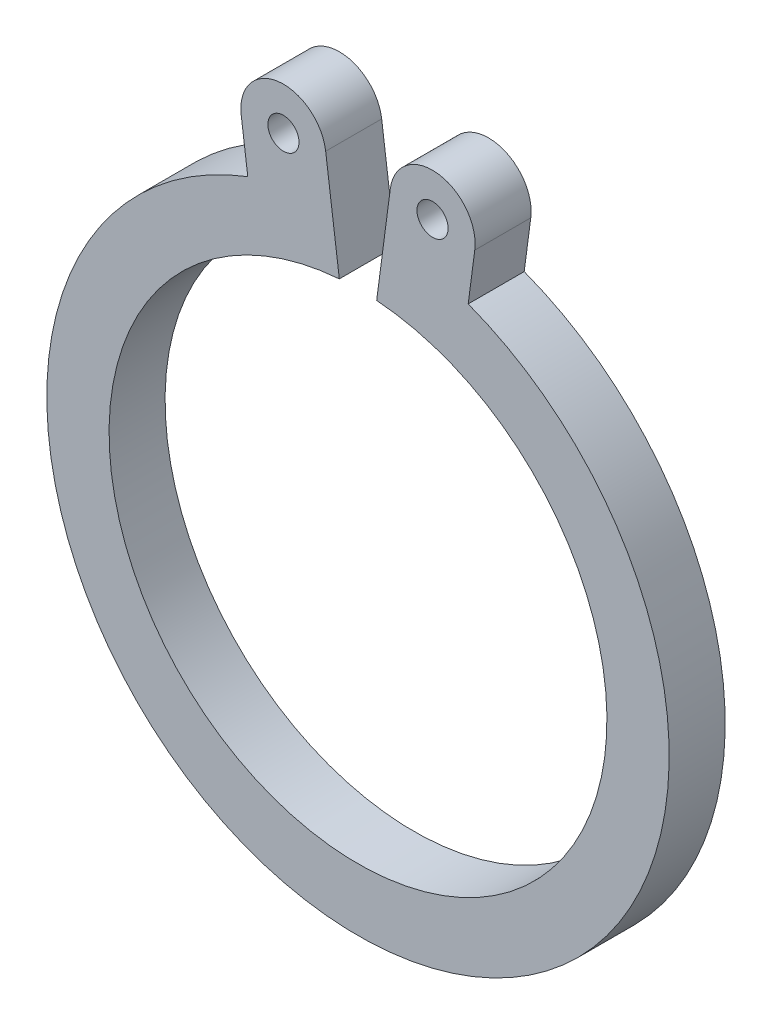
SolidWorks part; units mm, degrees
ref_plane "Plane1" through (0, 0, 0) normal (0, 0, 1) x (1, 0, 0)
ref_plane "Plane2" through (0, 0, 0) normal (0, 1, 0) x (1, 0, 0)
ref_plane "Plane3" through (0, 0, 0) normal (1, 0, 0) x (0, 0, -1)
sketch "Sketch1" plane through (0, 0, 0) normal (0, 0, 1) x (1, 0, 0)
  line L0 (0.5194, 5.6555) -> (0.3, 3.9887)
  line L1 (-1.7707, 4.676) -> (-1.8762, 5.4768)
  line L2 (1.7707, 4.676) -> (1.8762, 5.4768)
  line L3 (0, 0) -> (0, 66.3581) construction
  line L4 (-0.5194, 5.6555) -> (-0.3, 3.9887)
  line L5 (-0.5194, 5.6555) -> (-1.8762, 5.4768) construction
  line L6 (0.5194, 5.6555) -> (1.8762, 5.4768) construction
  arc A0 (-0.3, 3.9887) -> (0.3, 3.9887) centre (0, 0) ccw
  arc A1 (-1.7707, 4.676) -> (1.7707, 4.676) centre (0, 0) ccw
  arc A2 (-0.5194, 5.6555) -> (-1.8762, 5.4768) centre (-1.1978, 5.5661) ccw
  arc A3 (1.8762, 5.4768) -> (0.5194, 5.6555) centre (1.1978, 5.5661) ccw
  circle A4 centre (1.1978, 5.5661) radius 0.25
  circle A5 centre (-1.1978, 5.5661) radius 0.25
  dimension "D1" = 4
  dimension "D2" = 5
  dimension "D6" = 0.5
  dimension "D5" = 15
  dimension "D7" = 0.6
extrude "Base-Extrude" add sketch "Sketch1" along normal blind 0.9
